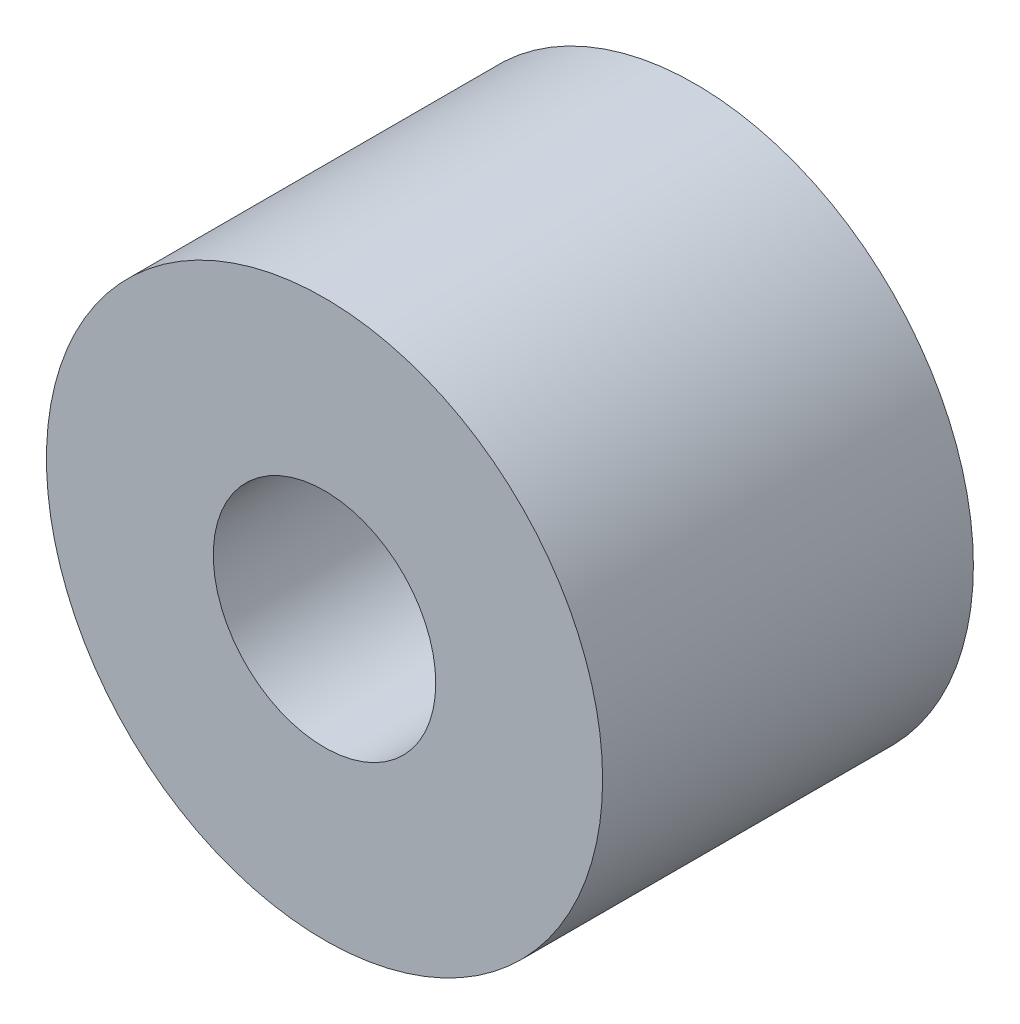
SolidWorks part; units mm, degrees
ref_plane "Plane1" through (0, 0, 0) normal (0, 0, 1) x (1, 0, 0)
ref_plane "Plane2" through (0, 0, 0) normal (0, 1, 0) x (1, 0, 0)
ref_plane "Plane3" through (0, 0, 0) normal (1, 0, 0) x (0, 0, -1)
sketch "Sketch1" plane through (0, 0, 0) normal (0, 0, 1) x (1, 0, 0)
  circle A0 centre (0, 0) radius 9.525
  circle A1 centre (0, 0) radius 3.81
  dimension "D1" = 19.05
  dimension "D2" = 7.62
extrude "Base-Extrude" add sketch "Sketch1" against normal blind 12.7
sketch "Sketch2" plane through (0, 0, -12.7) normal (0, 0, -1) x (-1, 0, 0)
  circle A0 centre (0, 0) radius 9.525 construction
  point P0 (0, 0)
sketch "Sketch3" plane through (0, 0, 0) normal (0, 0, 1) x (1, 0, 0)
  point P0 (0, 0)
